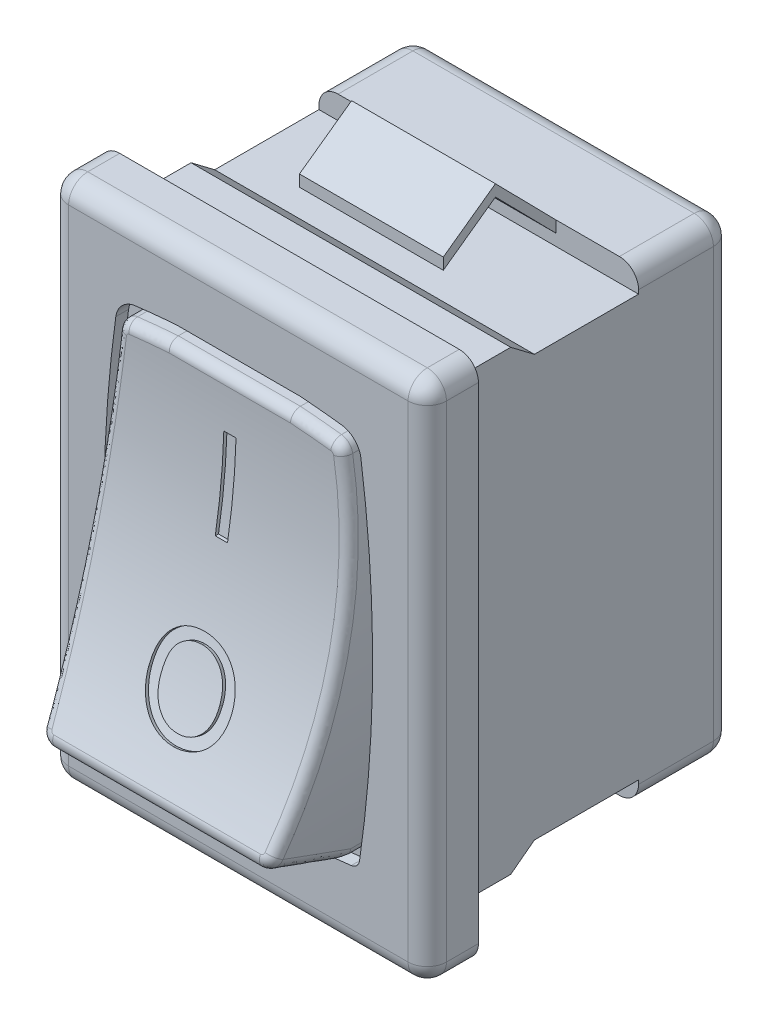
SolidWorks part; units mm, degrees
ref_plane "Plane1" through (0, 0, 0) normal (0, 0, 1) x (1, 0, 0)
ref_plane "Plane2" through (0, 0, 0) normal (0, 1, 0) x (1, 0, 0)
ref_plane "Plane3" through (0, 0, 0) normal (1, 0, 0) x (0, 0, -1)
sketch "Sketch1" plane through (0, 0, 0) normal (0, 0, 1) x (1, 0, 0)
  line L4 (-12.4587, 10.414) -> (2.5527, 10.414)
  line L5 (-12.4587, 10.414) -> (-12.4587, -10.414)
  line L6 (2.5527, -10.414) -> (-12.4587, -10.414)
  line L7 (2.5527, -10.414) -> (2.5527, 10.414)
  point P0 (-4.953, 10.414)
  dimension "D1" = 15.0114
  dimension "D2" = 20.828
  dimension "D3" = 2.5527
  dimension "D4" = 10.414
extrude "Base-Extrude" add sketch "Sketch1" against normal blind 2.032
sketch "Sketch2" plane through (0, 0, -2.032) normal (0, 0, -1) x (-1, 0, 0)
  line L0 (-1.397, 9.271) -> (11.303, 9.271)
  line L1 (-1.397, 9.271) -> (-1.397, -9.271)
  line L2 (11.303, -9.271) -> (-1.397, -9.271)
  line L3 (11.303, -9.271) -> (11.303, 9.271)
  line L4 (4.953, -10.414) -> (4.953, 11.0998) construction
  line L5 (-2.5527, -10.414) -> (12.4587, -10.414) construction
  line L6 (12.4587, 10.414) -> (-2.5527, 10.414) construction
  dimension "D1" = 6.35
  dimension "D2" = 6.35
  dimension "D3" = 18.542
  dimension "D4" = 1.143
extrude "Boss-Extrude1" add sketch "Sketch2" along normal blind 11.2522
sketch "Sketch3" plane through (1.397, 0, 0) normal (1, 0, 0) x (0, 0, -1)
  line L0 (9.5504, 9.271) -> (9.5504, 8.3566)
  line L2 (9.5504, 9.271) -> (2.032, 9.271)
  line L3 (9.5504, 8.3566) -> (5.4102, 8.3566)
  line L5 (5.4102, 8.3566) -> (4.4704, 9.0678)
  line L6 (4.4704, 9.0678) -> (2.032, 9.0678)
  line L7 (2.032, -10.414) -> (2.032, 10.414) construction
  line L8 (2.032, 9.271) -> (2.032, 9.0678)
extrude "Cut-Extrude1" cut sketch "Sketch3" against normal through all
mirror "Mirror1" about plane through (0, 0, 0) normal (0, 1, 0) of "Cut-Extrude1"
ref_plane "Plane4" through (2.5527, 0, 0) normal (1, 0, 0) x (0, 0, -1)
ref_plane "Plane5" through (-1.8923, 0, 0) normal (1, 0, 0) x (0, 0, -1)
sketch "Sketch4" plane through (-1.8923, 0, 0) normal (1, 0, 0) x (0, 0, -1)
  line L0 (2.032, -10.414) -> (2.032, 10.414) construction
  line L2 (9.5504, 9.271) -> (7.1529, 11.7103)
  line L3 (7.1529, 11.7103) -> (5.082, 10.2238)
  line L5 (5.082, 10.2238) -> (5.082, 9.7666)
  line L6 (9.5504, 9.271) -> (9.5504, 8.8138)
  line L8 (9.5504, 8.8138) -> (7.1529, 11.2531)
  line L9 (7.1529, 11.2531) -> (5.082, 9.7666)
  dimension "D1" = 0.4572
  dimension "D2" = 3.05
extrude "Boss-Extrude2" add sketch "Sketch4" against normal blind 5.715
mirror "Mirror2" about plane through (0, 0, 0) normal (0, 1, 0) of "Boss-Extrude2"
sketch "Sketch5" plane through (0, 0, 0) normal (0, 0, 1) x (1, 0, 0)
  line L0 (0, -7.3787) -> (0, 7.3787) construction
  line L1 (0, 0) -> (-9.906, 0) construction
  line L2 (0, 7.3787) -> (-9.906, 7.3787) construction
  line L3 (0, -7.3787) -> (-9.906, -7.3787) construction
  line L4 (-9.906, 7.3787) -> (-9.906, -7.3787) construction
  line L5 (-4.953, 7.3787) -> (-4.953, -7.3787) construction
  arc A0 (-9.3903, 7.08) -> (-0.5157, 7.08) centre (-4.953, -25.7343) cw
  arc A1 (-9.3903, -7.08) -> (-0.5157, -7.08) centre (-4.953, 25.7343) ccw
  arc A2 (-0.5157, 7.08) -> (-0.5157, -7.08) centre (-48.8581, 0) cw
  arc A3 (-9.3903, 7.08) -> (-9.3903, -7.08) centre (38.9521, 0) ccw
  dimension "D1" = 14.7574
  dimension "D2" = 9.906
extrude "Boss-Extrude3" add sketch "Sketch5" along normal blind 3.5052
ref_plane "Plane6" through (-4.953, 0, 0) normal (1, 0, 0) x (0, 0, -1)
sketch "Sketch6" plane through (-4.953, 0, 0) normal (1, 0, 0) x (0, 0, -1)
  line L0 (0, -7.366) -> (-3.429, -6.0242)
  line L1 (0, -10.414) -> (0, 10.414) construction
  line L3 (-0.3556, 7.2898) -> (0, 7.2898)
  line L4 (0, 7.2898) -> (0, 7.3787)
  line L5 (0, 7.3787) -> (-3.5052, 7.3787)
  line L6 (-3.5052, 7.08) -> (-3.5052, -7.08) construction
  line L7 (-3.5052, -7.3787) -> (0, -7.3787)
  line L8 (0, -7.3787) -> (0, -7.366)
  line L9 (-3.5052, 7.3787) -> (-3.5052, -7.3787)
  line L12 (-3.5052, -7.3787) -> (0, -7.3787) construction
  line L13 (0, 7.3787) -> (-3.5052, 7.3787) construction
  arc A0 (-3.429, -6.0242) -> (-0.3556, 7.2898) centre (-25.1635, 6.0047) ccw
  dimension "D1" = 24.8412
extrude "Cut-Extrude9" cut sketch "Sketch6" along normal up to surface and the other way up to surface
fillet "Fillet10" radius 0.762 8 edges at (-4.953, 10.414, 0) (2.5527, 0, 0) (-4.953, -10.414, 0) (-12.4587, 0, 0) (-12.4587, 10.414, -1.016) (2.5527, 10.414, -1.016) (2.5527, -10.414, -1.016) (-12.4587, -10.414, -1.016)
fillet "Fillet11" radius 0.762 8 edges at (1.397, 9.271, -11.4173) (-4.953, -9.271, -13.2842) (1.397, -9.271, -11.4173) (-11.303, -9.271, -11.4173) (-4.953, 9.271, -13.2842) (-11.303, 9.271, -11.4173) (1.397, 0, -13.2842) (-11.303, 0, -13.2842)
sketch "Sketch8" plane through (0, 0, -13.2842) normal (0, 0, -1) x (-1, 0, 0)
  line L2 (8.763, -7.366) -> (1.143, -7.366)
  line L3 (8.763, -7.366) -> (8.763, -6.4008)
  line L4 (1.143, -6.4008) -> (8.763, -6.4008)
  line L5 (1.143, -6.4008) -> (1.143, -7.366)
  line L8 (8.763, -0.3556) -> (1.143, -0.3556)
  line L9 (8.763, -0.3556) -> (8.763, 0.6096)
  line L10 (1.143, 0.6096) -> (8.763, 0.6096)
  line L11 (1.143, 0.6096) -> (1.143, -0.3556)
  line L12 (8.763, 6.4008) -> (1.143, 6.4008)
  line L13 (8.763, 6.4008) -> (8.763, 7.366)
  line L14 (1.143, 7.366) -> (8.763, 7.366)
  line L15 (1.143, 7.366) -> (1.143, 6.4008)
extrude "Cut-Extrude4" cut sketch "Sketch8" against normal blind 0.254
fillet "Fillet12" radius 0.508 10 edges at (-0.5157, -7.08, 0.3654) (-9.3903, -7.08, 0.3654) (-7.634, -7.27, 0.2454) (-9.3903, 7.08, 0.1728) (-0.5157, 7.08, 0.1728) (-0.4414, -6.5525, 2.0789) (-0.0126, 1.111, 0.8091) (-9.9053, -0.2544, 1.1238) (-9.4646, -6.5525, 2.0789)
sketch "Sketch15" plane through (0, 0, 0) normal (0, 0, 1) x (1, 0, 0)
  line L0 (-5.8753, -7.747) -> (-4.0307, -7.747)
  line L1 (-2.5143, 7.6708) -> (-7.3917, 7.6708)
  line L2 (-5.87, -7.366) -> (-4.036, -7.366)
  line L3 (-2.5282, 7.2898) -> (-7.3778, 7.2898)
  line L4 (-5.87, -7.366) -> (-4.036, -7.366)
  line L5 (-2.5282, 7.2898) -> (-7.3778, 7.2898)
  arc A0 (-4.0307, -7.747) -> (-0.4647, -7.4576) centre (-4.953, 25.7343) ccw
  arc A1 (-9.4413, -7.4576) -> (-5.8753, -7.747) centre (-4.953, 25.7343) ccw
  arc A2 (-9.8225, 6.7476) -> (-9.7673, -7.1353) centre (38.9521, 0) ccw
  arc A3 (-9.0506, 7.5081) -> (-9.8225, 6.7476) centre (-8.9419, 6.6258) ccw
  arc A4 (-7.3917, 7.6708) -> (-9.0506, 7.5081) centre (-4.953, -25.7343) ccw
  arc A5 (-0.8554, 7.5081) -> (-2.5143, 7.6708) centre (-4.953, -25.7343) ccw
  arc A6 (-0.0835, 6.7476) -> (-0.8554, 7.5081) centre (-0.9641, 6.6258) ccw
  arc A7 (-0.1387, -7.1353) -> (-0.0835, 6.7476) centre (-48.8581, 0) ccw
  arc A8 (-4.036, -7.366) -> (-0.5515, -7.0849) centre (-4.953, 25.7343) ccw
  arc A9 (-9.3545, -7.0849) -> (-5.87, -7.366) centre (-4.953, 25.7343) ccw
  arc A10 (-9.4451, 6.6954) -> (-9.4174, -6.8922) centre (38.9521, 0) ccw
  arc A11 (-9.004, 7.13) -> (-9.4451, 6.6954) centre (-8.9419, 6.6258) ccw
  arc A12 (-7.3778, 7.2898) -> (-9.004, 7.13) centre (-4.953, -25.7343) ccw
  arc A13 (-0.902, 7.13) -> (-2.5282, 7.2898) centre (-4.953, -25.7343) ccw
  arc A14 (-0.4609, 6.6954) -> (-0.902, 7.13) centre (-0.9641, 6.6258) ccw
  arc A15 (-0.4886, -6.8922) -> (-0.4609, 6.6954) centre (-48.8581, 0) ccw
  arc A16 (-4.036, -7.366) -> (-0.5515, -7.0849) centre (-4.953, 25.7343) ccw
  arc A17 (-9.3545, -7.0849) -> (-5.87, -7.366) centre (-4.953, 25.7343) ccw
  arc A18 (-9.4451, 6.6954) -> (-9.4174, -6.8922) centre (38.9521, 0) ccw
  arc A19 (-9.004, 7.13) -> (-9.4451, 6.6954) centre (-8.9419, 6.6258) ccw
  arc A20 (-7.3778, 7.2898) -> (-9.004, 7.13) centre (-4.953, -25.7343) ccw
  arc A21 (-0.902, 7.13) -> (-2.5282, 7.2898) centre (-4.953, -25.7343) ccw
  arc A22 (-0.4609, 6.6954) -> (-0.902, 7.13) centre (-0.9641, 6.6258) ccw
  arc A23 (-0.4886, -6.8922) -> (-0.4609, 6.6954) centre (-48.8581, 0) ccw
  arc A24 (-0.1387, -7.1353) -> (-0.4647, -7.4576) centre (-0.5157, -7.08) cw
  arc A25 (-9.7673, -7.1353) -> (-9.4413, -7.4576) centre (-9.3903, -7.08) ccw
  spline S2 degree 3 poles (-9.4174, -6.8922) (-9.4078, -6.9601) (-9.3869, -7.0244) (-9.3545, -7.0849) knots 0 0 0 0 1 1 1 1
  spline S3 degree 3 poles (-0.5515, -7.0849) (-0.5191, -7.0244) (-0.4982, -6.9601) (-0.4886, -6.8922) knots 0 0 0 0 1 1 1 1
  spline S4 degree 3 poles (-9.4174, -6.8922) (-9.4078, -6.9601) (-9.3869, -7.0244) (-9.3545, -7.0849) knots 0 0 0 0 1 1 1 1
  spline S5 degree 3 poles (-0.5515, -7.0849) (-0.5191, -7.0244) (-0.4982, -6.9601) (-0.4886, -6.8922) knots 0 0 0 0 1 1 1 1
  dimension "D3" = 0.381
  dimension "D1" = 0
  dimension "D2" = 0.381
extrude "Cut-Extrude10" cut sketch "Sketch15" against normal blind 0.508
fillet "Fillet13" radius 0.381 12 edges at (-4.953, 7.2898, 0.3556) (-4.953, -6.0242, 3.429) (-9.0106, -6.5816, 2.0045) (-9.9053, -0.2544, 1.1238) (-0.0126, 1.111, 0.8091) (-0.6148, 6.9946, 0.3421) (-9.3052, 6.9808, 0.3415) (-9.4374, -5.8923, 3.3565) (-0.5131, -5.9276, 3.3758)
ref_plane "Plane7" through (0, 0, 3.175) normal (0, 0, 1) x (1, 0, 0)
sketch "Sketch17" plane through (0, 0, 3.175) normal (0, 0, 1) x (1, 0, 0)
  text T0 "I"
extrude "Cut-Extrude15" cut sketch "Sketch17" against normal offset from surface (2.9695 mm away) 0.127
ref_plane "Plane8" through (0, 1.1291, 3.1021) normal (0, 0.342, 0.9397) x (1, 0, 0)
sketch "Sketch18" plane through (0, 1.1291, 3.1021) normal (0, 0.342, 0.9397) x (1, 0, 0)
  text T0 "O"
extrude "Cut-Extrude17" cut sketch "Sketch18" against normal offset from surface (2.5688 mm away) 0.127
